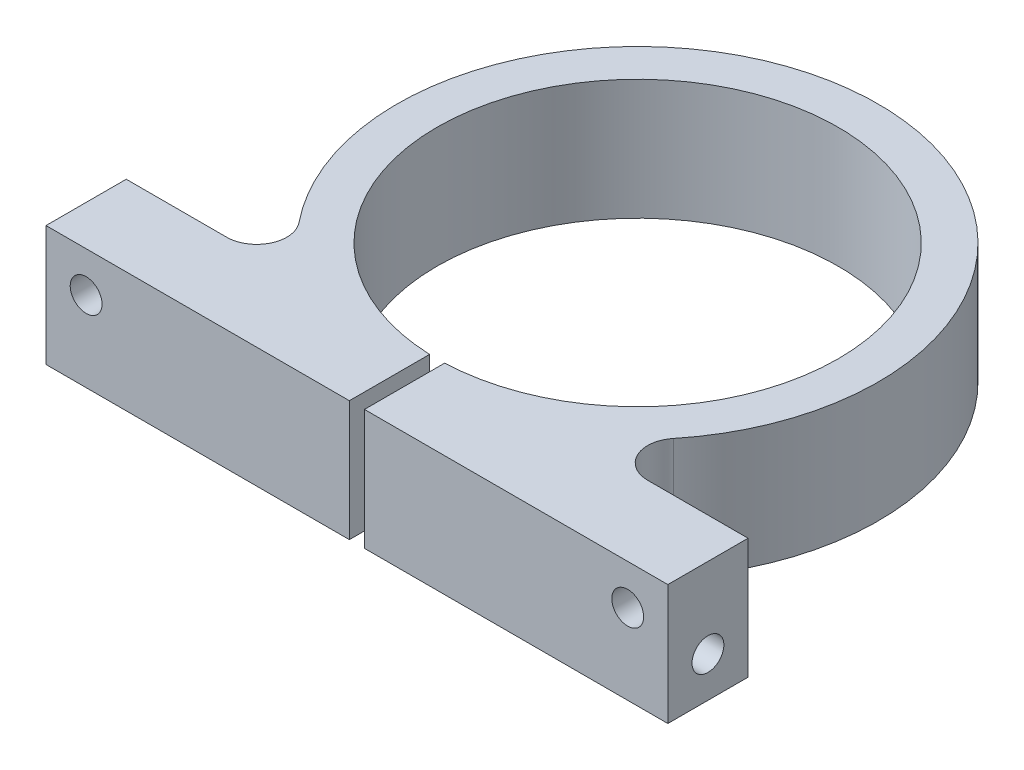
SolidWorks part; units mm, degrees
ref_plane "Front Plane" through (0, 0, 0) normal (0, 0, 1) x (1, 0, 0)
ref_plane "Top Plane" through (0, 0, 0) normal (0, 1, 0) x (1, 0, 0)
ref_plane "Right Plane" through (0, 0, 0) normal (1, 0, 0) x (0, 0, -1)
sketch "Sketch1" plane through (0, 0, 0) normal (0, 1, 0) x (1, 0, 0)
  line L0 (2.3876, -88.8551) -> (98.425, -88.8551)
  line L1 (-98.425, -63.4551) -> (-66.6357, -63.4551)
  line L2 (-98.425, -63.4551) -> (-98.425, -88.8551)
  line L3 (-98.425, -88.8551) -> (-2.3876, -88.8551)
  line L4 (98.425, -63.4551) -> (98.425, -88.8551)
  line L5 (66.6357, -63.4551) -> (98.425, -63.4551)
  line L6 (-76.2, 0) -> (76.2, 0) construction
  line L8 (-2.3876, -88.8551) -> (-2.3876, -63.4551)
  line L10 (2.3876, -88.8551) -> (2.3876, -63.4551)
  arc A0 (2.3876, -63.4551) -> (-2.3876, -63.4551) centre (0, 0) ccw
  arc A1 (59.2318, -47.9379) -> (-59.2318, -47.9379) centre (0, 0) ccw
  arc A5 (-66.6357, -63.4551) -> (-59.2318, -47.9379) centre (-66.6357, -53.9301) ccw
  arc A6 (66.6357, -63.4551) -> (59.2318, -47.9379) centre (66.6357, -53.9301) cw
  dimension "D3" = 12.7
  dimension "D4" = 63.5
  dimension "D10" = 9.525
  dimension "D1" = 22.225
  dimension "D5" = 25.4
  dimension "D6" = 4.7752
  dimension "D7" = 2.3876
  dimension "D9" = 22.225
extrude "Extrude1" add sketch "Sketch1" along normal blind 38.1
hole_wizard "3/8 Clearance Hole2" positions "3DSketch1" profile "Sketch2" hole size "3/8" standard "Ansi Inch"
sketch3d "3DSketch1"
  line L2 (-98.425, 38.1, 88.8551) -> (-98.425, 0, 88.8551) construction
  line L3 (-98.425, 38.1, 63.4551) -> (-98.425, 38.1, 88.8551) construction
  point P0 (-98.425, 12.7, 76.1551)
  dimension "D1" = 25.4
  dimension "D2" = 12.7
sketch "Sketch2" plane through (-98.425, 12.7, 76.1551) normal (0, 1, 0) x (0, 0, 1)
  line L0 (0, 0) -> (0, 196.85)
  line L1 (0, 196.85) -> (5.0419, 196.85)
  line L2 (5.0419, 196.85) -> (5.0419, 0)
  line L5 (5.0419, 0) -> (0, 0)
  line L11 (0, -6.35) -> (0, 107.95) construction
  dimension "Thru Hole Dia." = 10.0838
  dimension "Thru Hole Depth" = 196.85
hole_wizard "3/8 Clearance Hole1" positions "3DSketch2" profile "Sketch3" hole size "3/8" standard "Ansi Inch"
sketch3d "3DSketch2"
  line L0 (-98.425, 38.1, 63.4551) -> (-98.425, 0, 63.4551) construction
  line L1 (-66.6357, 38.1, 63.4551) -> (-98.425, 38.1, 63.4551) construction
  point P0 (-85.725, 25.4, 63.4551)
  dimension "D1" = 12.7
  dimension "D2" = 12.7
sketch "Sketch3" plane through (-85.725, 25.4, 63.4551) normal (1, 0, 0) x (0, 1, 0)
  line L0 (0, 0) -> (0, 25.4)
  line L1 (0, 25.4) -> (5.0419, 25.4)
  line L2 (5.0419, 25.4) -> (5.0419, 0)
  line L5 (5.0419, 0) -> (0, 0)
  line L11 (0, -6.35) -> (0, 107.95) construction
  dimension "Thru Hole Dia." = 10.0838
  dimension "Thru Hole Depth" = 25.4
hole_wizard "3/8 Clearance Hole3" positions "3DSketch3" profile "Sketch4" hole size "3/8" standard "Ansi Inch"
sketch3d "3DSketch3"
  line L0 (98.425, 38.1, 63.4551) -> (98.425, 0, 63.4551) construction
  line L1 (98.425, 38.1, 63.4551) -> (66.6357, 38.1, 63.4551) construction
  point P0 (85.725, 25.4, 63.4551)
  dimension "D1" = 12.7
  dimension "D2" = 12.7
sketch "Sketch4" plane through (85.725, 25.4, 63.4551) normal (1, 0, 0) x (0, 1, 0)
  line L0 (0, 0) -> (0, 25.4)
  line L1 (0, 25.4) -> (5.0419, 25.4)
  line L2 (5.0419, 25.4) -> (5.0419, 0)
  line L5 (5.0419, 0) -> (0, 0)
  line L11 (0, -6.35) -> (0, 107.95) construction
  dimension "Thru Hole Dia." = 10.0838
  dimension "Thru Hole Depth" = 25.4
